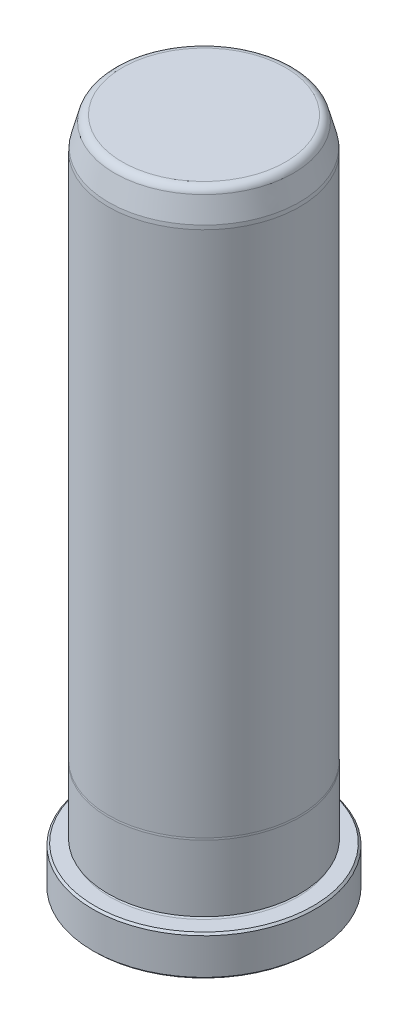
SolidWorks part; units mm, degrees
ref_plane "Front Plane" through (0, 0, 0) normal (0, 0, 1) x (1, 0, 0)
ref_plane "Top Plane" through (0, 0, 0) normal (0, 1, 0) x (1, 0, 0)
ref_plane "Right Plane" through (0, 0, 0) normal (1, 0, 0) x (0, 0, -1)
sketch "Sketch1" plane through (0, 0, 0) normal (1, 0, 0) x (0, 0, -1)
  line L0 (0, 0) -> (22.098, 0)
  line L1 (22.098, 0) -> (22.098, 7.9248)
  line L2 (22.098, 7.9248) -> (18.6563, 7.9248)
  line L3 (18.2753, 4.7498) -> (18.2753, 5.5118) construction
  line L4 (18.6563, 8.6868) -> (19.0627, 8.6868)
  line L5 (19.0627, 8.6868) -> (19.0627, 21.8618)
  line L6 (19.0627, 21.8618) -> (19.0373, 22.225)
  line L7 (19.0373, 22.225) -> (19.0373, 127)
  line L9 (17.4733, 133.35) -> (0, 133.35)
  line L10 (0, 133.35) -> (0, 0)
  line L11 (0, 0) -> (0, -13.6287) construction
  line L12 (19.0373, 127) -> (18.9706, 127.762)
  line L13 (18.9706, 127.762) -> (17.4733, 133.35)
  arc A0 (18.6563, 8.6868) -> (18.6563, 7.9248) centre (18.6563, 8.3058) ccw
  dimension "D14" = 0.762
  dimension "T" = 7.9248
  dimension "D2" = 0.762
  dimension "M" = 44.196
  dimension "B" = 38.1254
  dimension "L" = 133.35
  dimension "D7" = 0.7874
  dimension "A" = 22.225
  dimension "D8" = 4
  dimension "D10" = 5
  dimension "D11" = 15
  dimension "D12" = 0.762
  dimension "K" = 6.35
  dimension "D" = 38.0746
revolve "Revolve1" add sketch "Sketch1" angle 360 about L11
fillet "Fillet6" radius 1.5875 1 edges at (0, 133.35, 17.4733)
chamfer "Chamfer1" distance 0.381 angle 45 2 edges at (0, 0, 22.098) (0, 7.9248, 22.098)
